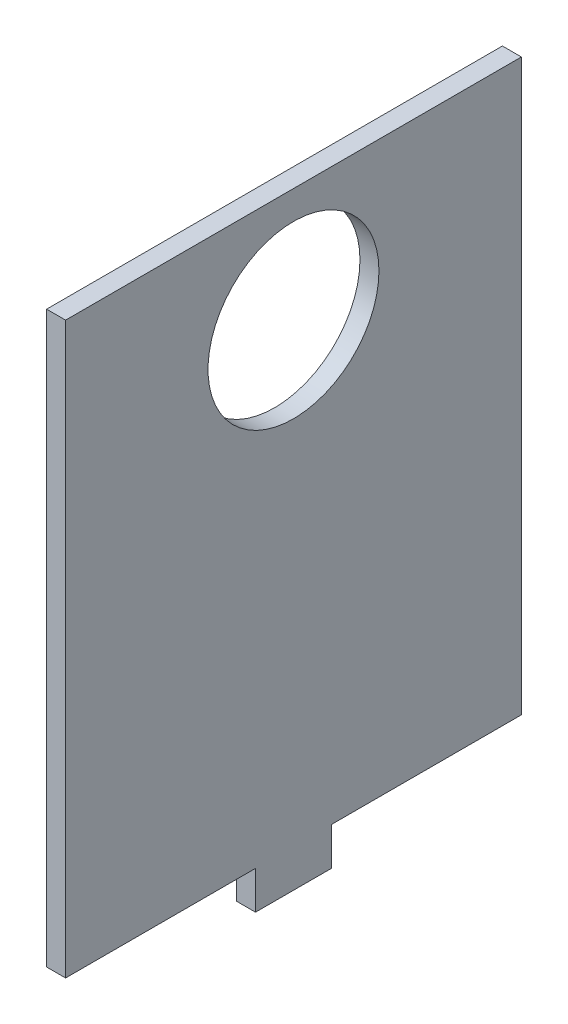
SolidWorks part; units mm, degrees
ref_plane "Front Plane" through (0, 0, 0) normal (0, 0, 1) x (1, 0, 0)
ref_plane "Top Plane" through (0, 0, 0) normal (0, 1, 0) x (1, 0, 0)
ref_plane "Right Plane" through (0, 0, 0) normal (1, 0, 0) x (0, 0, -1)
sketch "Sketch1" plane through (0, 0, 0) normal (1, 0, 0) x (0, 0, -1)
  line L1 (0, 0) -> (152.4, 0)
  line L2 (0, 0) -> (0, 203.2)
  line L3 (0, 203.2) -> (152.4, 203.2)
  line L4 (152.4, 0) -> (152.4, 203.2)
  dimension "D1" = 152.4
  dimension "D2" = 203.2
extrude "Boss-Extrude1" add sketch "Sketch1" along normal blind 6.35
sketch "Sketch2" plane through (6.35, 0, 0) normal (1, 0, 0) x (0, 0, -1)
  line L0 (76.2, 0) -> (63.5, 0)
  line L1 (0, 0) -> (152.4, 0) construction
  line L2 (76.2, 0) -> (88.9, 0)
  line L3 (63.5, 0) -> (63.5, 12.7)
  line L4 (63.5, 12.7) -> (0, 12.7)
  line L5 (0, 203.2) -> (0, 0) construction
  line L6 (88.9, 0) -> (88.9, 12.7)
  line L7 (88.9, 12.7) -> (152.4, 12.7)
  line L8 (152.4, 0) -> (152.4, 203.2) construction
  line L9 (63.5, 0) -> (0, 0)
  line L10 (0, 0) -> (0, 12.7)
  line L11 (88.9, 0) -> (152.4, 0)
  line L12 (152.4, 0) -> (152.4, 12.7)
  dimension "D1" = 12.7
  dimension "D2" = 12.7
  dimension "D3" = 12.7
  dimension "D4" = 12.7
extrude "Cut-Extrude1" cut sketch "Sketch2" against normal blind 6.35 contours L3 L4 M5 M6 | L7 L6 M6 M7
sketch "Sketch3" plane through (6.35, 0, 0) normal (1, 0, 0) x (0, 0, -1)
  line L0 (76.2, 203.2) -> (76.2, 165.1)
  line L1 (152.4, 203.2) -> (0, 203.2) construction
  circle A0 centre (76.2, 165.1) radius 28.575
  dimension "D1" = 57.15
  dimension "D2" = 38.1
extrude "Cut-Extrude2" cut sketch "Sketch3" against normal blind 6.35
